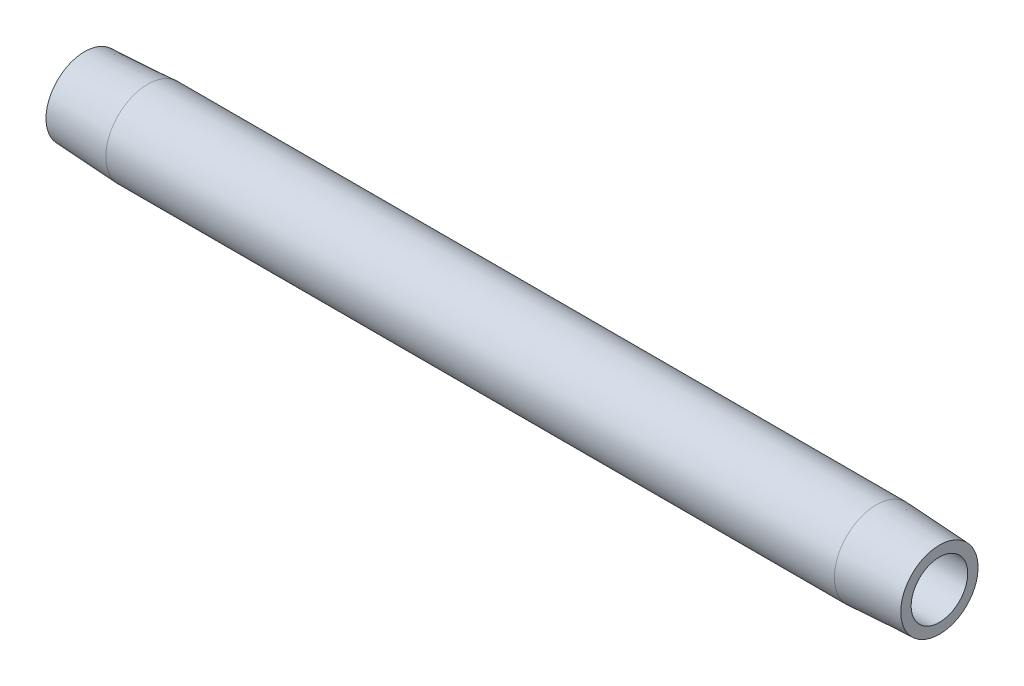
SolidWorks part; units mm, degrees
ref_plane "Front Plane" through (0, 0, 0) normal (0, 0, 1) x (1, 0, 0)
ref_plane "Top Plane" through (0, 0, 0) normal (0, 1, 0) x (1, 0, 0)
ref_plane "Right Plane" through (0, 0, 0) normal (1, 0, 0) x (0, 0, -1)
sketch "Sketch1" plane through (0, 0, 0) normal (0, 1, 0) x (1, 0, 0)
  line L6 (139.7, 4.6228) -> (0, 4.6228)
  line L7 (10.3124, 6.858) -> (0, 6.3175)
  line L8 (0, 6.3175) -> (0, 4.6228)
  line L9 (129.3876, 6.858) -> (10.3124, 6.858)
  line L10 (139.7, 6.3175) -> (129.3876, 6.858)
  line L11 (139.7, 4.6228) -> (139.7, 6.3175)
  line L12 (-6.376, 0) -> (49993.624, 0) construction
  dimension "D1" = 9.2456
  dimension "D2" = 13.716
  dimension "D3" = 3
  dimension "D4" = 3
  dimension "D5" = 139.7
  dimension "D6" = 10.3124
  dimension "D7" = 10.3124
revolve "Revolve1" add sketch "Sketch1" angle 360 about L12
